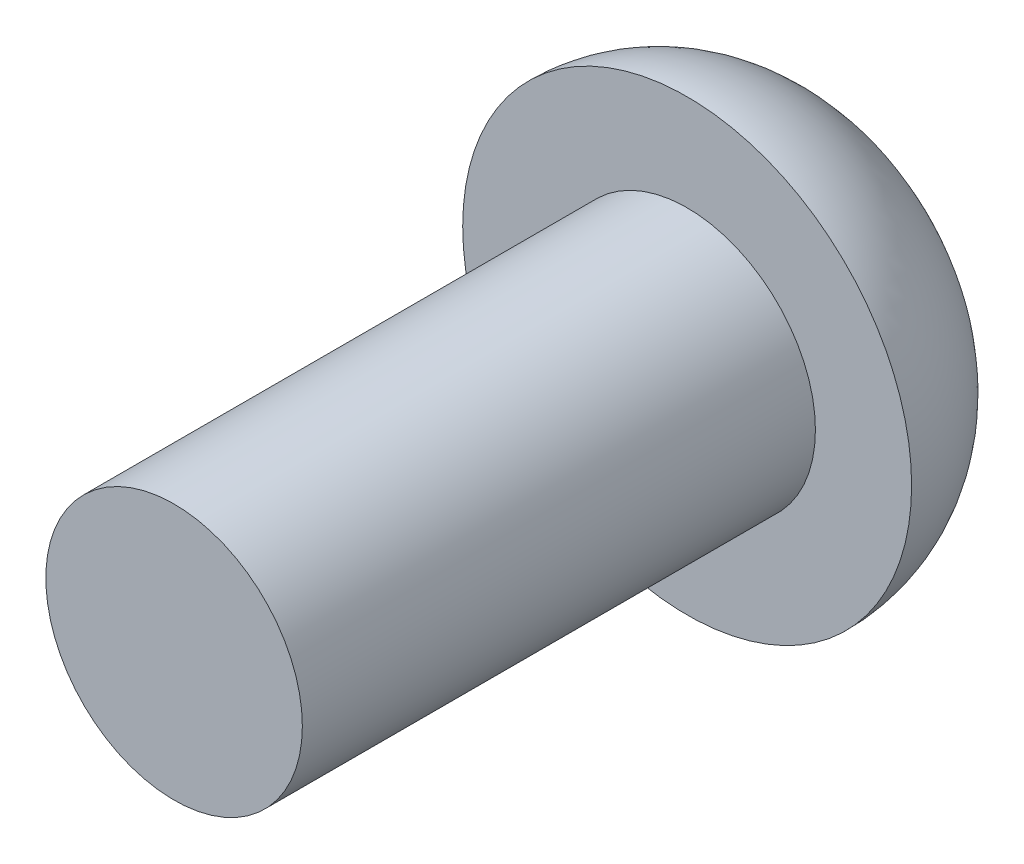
SolidWorks part; units mm, degrees
ref_plane "Alzado" through (0, 0, 0) normal (0, 0, 1) x (1, 0, 0)
ref_plane "Planta" through (0, 0, 0) normal (0, 1, 0) x (1, 0, 0)
ref_plane "Vista lateral" through (0, 0, 0) normal (1, 0, 0) x (0, 0, -1)
sketch "Croquis1" plane through (0, 0, 0) normal (0, 0, 1) x (1, 0, 0)
  circle A0 centre (0, 0) radius 7
extrude "Extruir1" add sketch "Croquis1" along normal blind 5
sketch "Croquis2" plane through (0, 0, 5) normal (0, 0, 1) x (1, 0, 0)
  circle A0 centre (0, 0) radius 4
extrude "Extruir2" add sketch "Croquis2" along normal blind 16
fillet "Redondeo2" radius 5 1 edges at (7, 0, 0)
